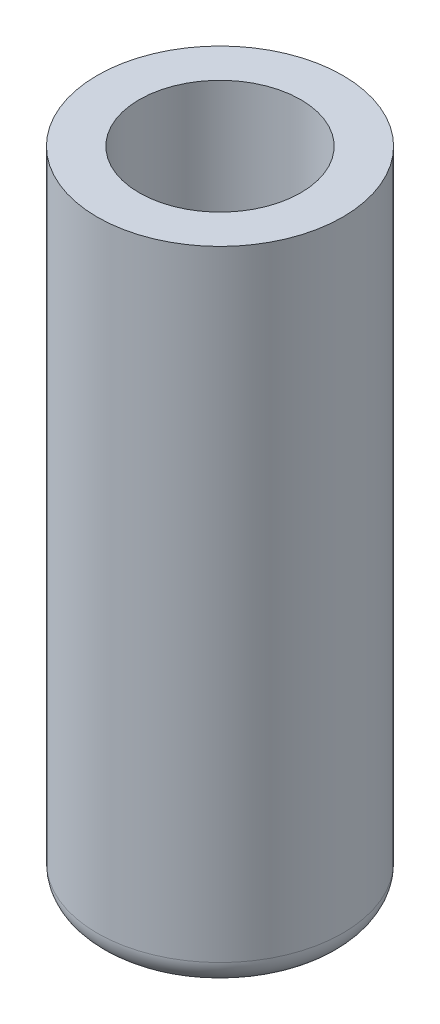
SolidWorks part; units mm, degrees
ref_plane "Top" through (0, 0, 0) normal (0, 0, 1) x (1, 0, 0)
ref_plane "Front" through (0, 0, 0) normal (0, 1, 0) x (1, 0, 0)
ref_plane "Side" through (0, 0, 0) normal (1, 0, 0) x (0, 0, -1)
sketch "Sketch1" plane through (0, 0, 0) normal (0, 1, 0) x (1, 0, 0)
  circle A0 centre (0, 0) radius 2.413
  dimension "D1" = 4.826
extrude "Base-Extrude" add sketch "Sketch1" along normal mid plane 12.7
sketch "Sketch2" plane through (0, 6.35, 0) normal (0, 1, 0) x (-1, 0, 0)
  circle A0 centre (0, 0) radius 1.5875
  dimension "D1" = 3.175
extrude "Cut-Extrude1" cut sketch "Sketch2" against normal through all
fillet "Fillet1" radius 0.508
